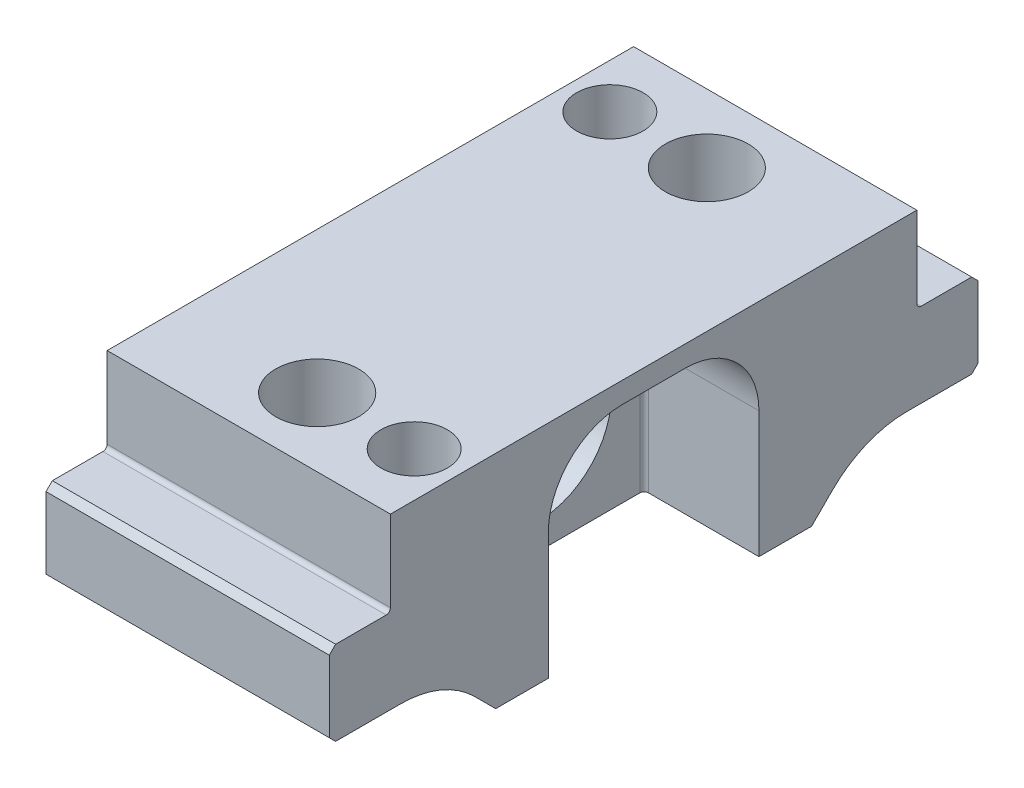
SolidWorks part; units mm, degrees
ref_plane "Front Plane" through (0, 0, 0) normal (0, 0, 1) x (1, 0, 0)
ref_plane "Top Plane" through (0, 0, 0) normal (0, 1, 0) x (1, 0, 0)
ref_plane "Right Plane" through (0, 0, 0) normal (1, 0, 0) x (0, 0, -1)
sketch "Sketch1" plane through (0, 0, 0) normal (0, 0, 1) x (1, 0, 0)
  line L0 (0, -13.335) -> (0, 13.335) construction
  line L2 (-17.0815, 13.335) -> (-17.0815, -13.335)
  line L3 (-17.0815, -13.335) -> (17.0815, -13.335)
  line L4 (17.0815, -13.335) -> (17.0815, 13.335)
  line L5 (17.0815, 13.335) -> (-17.0815, 13.335)
  dimension "D1" = 34.163
  dimension "D2" = 13.335
  dimension "D3" = 26.67
extrude "Boss-Extrude1" add sketch "Sketch1" along normal mid plane 81.28
sketch "Sketch2" plane through (17.0815, 0, 0) normal (1, 0, 0) x (0, 0, -1)
  line L0 (-39.116, 3.048) -> (-39.116, -7.0993)
  line L1 (-40.64, -13.335) -> (-19.05, -13.335)
  line L2 (-40.64, 13.335) -> (-40.64, -13.335)
  line L3 (-40.64, 13.335) -> (-31.7436, 13.335)
  line L4 (-19.05, -13.335) -> (-25.2857, -7.0993)
  line L5 (40.64, 13.335) -> (40.64, -13.335)
  line L6 (40.64, -13.335) -> (19.05, -13.335)
  line L7 (19.05, -13.335) -> (25.2857, -7.0993)
  line L8 (39.116, -7.0993) -> (25.2857, -7.0993)
  line L9 (-31.7436, 3.048) -> (-39.116, 3.048)
  line L10 (39.116, 3.048) -> (39.116, -7.0993)
  line L11 (-39.116, -7.0993) -> (-25.2857, -7.0993)
  line L12 (-31.7436, 3.048) -> (-31.7436, 13.335)
  line L13 (0, -13.335) -> (0, 13.335) construction
  line L14 (40.64, -13.335) -> (-40.64, -13.335) construction
  line L15 (31.7436, 3.048) -> (39.116, 3.048)
  line L16 (31.7436, 3.048) -> (31.7436, 13.335)
  line L17 (40.64, 13.335) -> (31.7436, 13.335)
  line L18 (-40.64, -13.335) -> (40.64, -13.335) construction
  line L19 (-40.64, 13.335) -> (40.64, 13.335) construction
  line L20 (-40.64, -13.335) -> (-40.64, 13.335) construction
  point P10 (0, 13.335)
  dimension "D1" = 63.4873
  dimension "D2" = 78.232
  dimension "D3" = 7.0993
  dimension "D4" = 10.1473
  dimension "D6" = 38.1
  dimension "D7" = 45
  dimension "D8" = 10.287
extrude "Cut-Extrude1 WAY CUTS" cut sketch "Sketch2" against normal through all
sketch "Sketch5" plane through (17.0815, 0, 0) normal (1, 0, 0) x (0, 0, -1)
  circle A0 centre (0, -1.4097) radius 8.7503
  dimension "D2" = 17.5006
  dimension "D1" = 1.4097
extrude "Cut-Extrude4 THREADED HOLE" cut sketch "Sketch5" against normal through all
sketch "Sketch6" plane through (17.0815, 0, 0) normal (1, 0, 0) x (0, 0, -1)
  line L0 (-19.05, -13.335) -> (19.05, -13.335) construction
  line L1 (-12.7, -13.335) -> (12.7, -13.335)
  line L2 (-12.7, -13.335) -> (-12.7, 10.795)
  line L3 (-12.7, 10.795) -> (12.7, 10.795)
  line L4 (12.7, -13.335) -> (12.7, 10.795)
  point P0 (0, 10.795)
  dimension "D1" = 25.4
  dimension "D2" = 24.13
extrude "Cut-Extrude5 THREAD RELIEF" cut sketch "Sketch6" against normal offset from surface (13.843 mm away) 20.32
fillet "Fillet3" radius 12.7 2 edges at (0, -7.0993, 25.2857) (0, -7.0993, -25.2857)
fillet "Fillet7" radius 8.89 2 edges at (10.16, 10.795, -12.7) (10.16, 10.795, 12.7)
fillet "Fillet5" radius 0.508 2 edges at (0, 3.048, 31.7436) (0, 3.048, -31.7436)
chamfer "Chamfer1" distance 0.762 angle 45 4 edges at (0, -7.0993, 39.116) (0, 3.048, 39.116) (0, -7.0993, -39.116) (0, 3.048, -39.116)
fillet "Fillet6" radius 0.508 5 edges at (3.2385, -5.715, -12.7) (3.2385, 8.1912, -10.0962) (3.2385, 10.795, 0) (3.2385, 8.1912, 10.0962) (3.2385, -5.715, 12.7)
hole_wizard "M10x1.5 Tapped Hole1 JAW MOUNT" positions "Sketch8" profile "Sketch7" tap size "M10x1.5" standard "ANSI Metric"
sketch "Sketch8" plane through (0, 13.335, 0) normal (0, 1, 0) x (-1, 0, 0)
  line L1 (0, 23.495) -> (0, -23.495) construction
  point P0 (0, -23.495)
  point P1 (0, 23.495)
  dimension "D1" = 46.99
sketch "Sketch7" plane through (0, 13.335, -23.495) normal (1, 0, 0) x (0, 0, 1)
  line L0 (0, 0) -> (0, 26.67)
  line L1 (0, 26.67) -> (4.25, 26.67)
  line L3 (4.25, 26.67) -> (4.25, 17.78)
  line L4 (4.25, 17.78) -> (5, 17.78)
  line L5 (5, 17.78) -> (5, 0)
  line L7 (5, 0) -> (0, 0)
  line L11 (0, -6.35) -> (0, 107.95) construction
  dimension "Thru Tap Drill Dia." = 8.5
  dimension "Thru Tap Drill Depth" = 26.67
  dimension "Thread Major Dia." = 10
  dimension "Thread Depth" = 17.78
sketch "LOCATING PIN SPREAD" plane through (0, 13.335, 0) normal (0, 1, 0) x (1, 0, 0)
  line L0 (-17.0815, 0) -> (17.0815, 0) construction
  line L1 (-17.0815, -31.7436) -> (-17.0815, 31.7436) construction
  line L2 (17.0815, -31.7436) -> (17.0815, 31.7436) construction
  line L3 (0, 23.495) -> (0, -23.495) construction
  line L4 (11.7, -23.5) -> (-11.7, 23.5) construction
  circle A0 centre (-11.7, 23.5) radius 4.0063
  circle A1 centre (11.7, -23.5) radius 4.0063
  point P12 (0, 0)
  dimension "D3" = 8.0127
  dimension "D1" = 23.4
  dimension "D2" = 47
sketch "Sketch9" plane through (0, 13.335, 0) normal (0, 1, 0) x (1, 0, 0)
  line L0 (-17.0815, 0) -> (17.0815, 0) construction
  line L2 (17.0815, -31.7436) -> (17.0815, 31.7436) construction
  line L3 (-17.0815, -31.7436) -> (-17.0815, 31.7436) construction
  circle A0 centre (-11.7, 23.5) radius 4.0094
  circle A1 centre (11.7, -23.5) radius 4.0094
  dimension "D1" = 8.0188
extrude "8MM DOWEL PIN JAW LOCATION" cut sketch "Sketch9" against normal blind 6.858
sketch "Sketch10" plane through (17.0815, 0, 0) normal (1, 0, 0) x (0, 0, -1)
  line L0 (12.7, -2.0832) -> (32.2516, -2.0832) construction
  line L1 (32.2516, 3.048) -> (38.354, 3.048) construction
  line L2 (12.7, -13.335) -> (12.7, 1.905) construction
  line L5 (32.2516, 3.048) -> (32.2516, -7.2143) construction
  arc A1 (31.7436, 3.556) -> (32.2516, 3.048) centre (32.2516, 3.556) ccw construction
  arc A2 (30.5462, -7.0993) -> (21.566, -10.819) centre (30.5462, -19.7993) ccw construction
sketch "Sketch11" plane through (17.0815, 0, 0) normal (1, 0, 0) x (0, 0, -1)
  text T0 "L" font "Century Gothic" height 6.35
extrude "Cut-Extrude1 L" [suppressed] cut sketch "Sketch11" against normal blind 0.127
sketch "Sketch12" plane through (17.0815, 0, 0) normal (1, 0, 0) x (0, 0, -1)
  text T0 "R" font "Century Gothic" height 6.35
extrude "Cut-Extrude1 R" [suppressed] cut sketch "Sketch12" against normal blind 0.127
hole_wizard "M5x0.8 Tapped Hole1" positions "Sketch14" profile "Sketch13" tap size "M5x0.8" standard "ANSI Metric"
sketch "Sketch14" plane through (0, 9.017, 0) normal (0, 1, 0) x (-1, 0, 0)
  point P0 (11.7, -23.5)
  point P1 (-11.7, 23.5)
sketch "Sketch13" plane through (-11.7, 9.017, -23.5) normal (1, 0, 0) x (0, 0, 1)
  line L0 (0, 0) -> (0, 13.6618)
  line L1 (0, 13.6618) -> (2.1, 12.4)
  line L2 (2.1, 12.4) -> (2.1, 10)
  line L3 (2.1, 10) -> (2.5, 10)
  line L4 (2.5, 10) -> (2.5, 0)
  line L5 (2.5, 0) -> (0, 0)
  line L10 (0, 13.6618) -> (-2.1, 12.4) construction
  line L11 (0, -6.35) -> (0, 107.95) construction
  dimension "Tap Drill Dia." = 4.2
  dimension "Tap Drill Depth" = 12.4
  dimension "Thread Major Dia." = 5
  dimension "Thread Depth" = 10
  dimension "Drill Angle" = 118
sketch "Sketch15" plane through (-17.0815, 0, 0) normal (-1, 0, 0) x (0, 0, 1)
  line L17 (30.5462, -7.0993) -> (38.354, -7.0993)
  line L18 (38.354, -7.0993) -> (39.116, -6.3373)
  line L19 (39.116, -6.3373) -> (39.116, 2.286)
  line L20 (39.116, 2.286) -> (38.354, 3.048)
  line L21 (38.354, 3.048) -> (32.2516, 3.048)
  line L22 (31.7436, 3.556) -> (31.7436, 13.335)
  line L23 (31.7436, 13.335) -> (-31.7436, 13.335)
  line L24 (-31.7436, 13.335) -> (-31.7436, 3.556)
  line L25 (-32.2516, 3.048) -> (-38.354, 3.048)
  line L26 (-38.354, 3.048) -> (-39.116, 2.286)
  line L27 (-39.116, 2.286) -> (-39.116, -6.3373)
  line L28 (-39.116, -6.3373) -> (-38.354, -7.0993)
  line L29 (-38.354, -7.0993) -> (-30.5462, -7.0993)
  line L30 (-21.566, -10.819) -> (-19.05, -13.335)
  line L31 (-19.05, -13.335) -> (19.05, -13.335)
  line L32 (19.05, -13.335) -> (21.566, -10.819)
  line L33 (30.5462, -7.0993) -> (38.354, -7.0993)
  line L34 (38.354, -7.0993) -> (39.116, -6.3373)
  line L35 (39.116, -6.3373) -> (39.116, 2.286)
  line L36 (39.116, 2.286) -> (38.354, 3.048)
  line L37 (38.354, 3.048) -> (32.2516, 3.048)
  line L38 (31.7436, 3.556) -> (31.7436, 13.335)
  line L39 (31.7436, 13.335) -> (-31.7436, 13.335)
  line L40 (-31.7436, 13.335) -> (-31.7436, 3.556)
  line L41 (-32.2516, 3.048) -> (-38.354, 3.048)
  line L42 (-38.354, 3.048) -> (-39.116, 2.286)
  line L43 (-39.116, 2.286) -> (-39.116, -6.3373)
  line L44 (-39.116, -6.3373) -> (-38.354, -7.0993)
  line L45 (-38.354, -7.0993) -> (-30.5462, -7.0993)
  line L46 (-21.566, -10.819) -> (-19.05, -13.335)
  line L47 (-19.05, -13.335) -> (19.05, -13.335)
  line L48 (19.05, -13.335) -> (21.566, -10.819)
  arc A4 (31.7436, 3.556) -> (32.2516, 3.048) centre (32.2516, 3.556) ccw
  arc A5 (-32.2516, 3.048) -> (-31.7436, 3.556) centre (-32.2516, 3.556) ccw
  arc A6 (-21.566, -10.819) -> (-30.5462, -7.0993) centre (-30.5462, -19.7993) ccw
  arc A7 (30.5462, -7.0993) -> (21.566, -10.819) centre (30.5462, -19.7993) ccw
  arc A8 (31.7436, 3.556) -> (32.2516, 3.048) centre (32.2516, 3.556) ccw
  arc A9 (-32.2516, 3.048) -> (-31.7436, 3.556) centre (-32.2516, 3.556) ccw
  arc A10 (-21.566, -10.819) -> (-30.5462, -7.0993) centre (-30.5462, -19.7993) ccw
  arc A11 (30.5462, -7.0993) -> (21.566, -10.819) centre (30.5462, -19.7993) ccw
  dimension "D1" = 0
extrude "Boss-Extrude2 MILL OP2" [suppressed] add sketch "Sketch15" along normal offset from surface (1.016 mm away) 31.496
sketch "Sketch16" [suppressed] plane through (0, 0, 0) normal (0, 0, 1) x (1, 0, 0)
  line L0 (-16.256, 0) -> (-21.844, 0) construction
  line L1 (-16.256, -6.477) -> (-16.256, 2.413) construction
  line L2 (-16.256, -19.05) -> (-16.256, 19.05)
  line L3 (-16.256, 19.05) -> (-19.812, 19.05)
  line L4 (-19.812, 19.05) -> (-19.812, 6.35)
  line L5 (-19.812, 6.35) -> (-21.59, 8.128)
  line L6 (-21.59, 8.128) -> (-21.844, 8.128)
  line L7 (-21.844, 8.128) -> (-21.844, -8.128)
  line L8 (15.24, 3.683) -> (15.24, 13.462) construction
  line L9 (-21.59, -8.128) -> (-21.844, -8.128)
  line L10 (-19.812, -6.35) -> (-21.59, -8.128)
  line L11 (-19.812, -19.05) -> (-19.812, -6.35)
  line L12 (-16.256, -19.05) -> (-19.812, -19.05)
  dimension "D1" = 45
  dimension "D2" = 0.254
  dimension "D3" = 6.35
  dimension "D4" = 2.032
  dimension "D5" = 19.05
  dimension "D6" = 35.052
extrude "Boss-Extrude3 MILL OP2 DOVETAIL" [suppressed] add sketch "Sketch16" along normal mid plane 81.28
sketch "Sketch17" [suppressed] plane through (-16.256, 0, 0) normal (1, 0, 0) x (0, 0, -1)
  line L0 (-31.877, 19.05) -> (-40.64, 19.05)
  line L1 (-40.64, 19.05) -> (-40.64, 3.175)
  line L2 (-40.64, 3.175) -> (-32.385, 3.175)
  line L3 (-31.877, 3.683) -> (-31.877, 19.05)
  line L4 (40.64, 19.05) -> (40.64, 3.175)
  line L5 (31.877, 19.05) -> (40.64, 19.05)
  line L6 (-40.64, -19.05) -> (-40.64, 19.05) construction
  line L7 (31.877, 3.683) -> (31.877, 19.05)
  line L8 (0, -19.05) -> (0, 19.05) construction
  line L9 (40.64, 3.175) -> (32.385, 3.175)
  line L10 (-40.64, -19.05) -> (40.64, -19.05) construction
  line L11 (-40.64, 19.05) -> (40.64, 19.05) construction
  arc A0 (-32.385, 3.175) -> (-31.877, 3.683) centre (-32.385, 3.683) ccw construction
  arc A1 (-32.385, 3.175) -> (-31.877, 3.683) centre (-32.385, 3.683) ccw
  arc A2 (32.385, 3.175) -> (31.877, 3.683) centre (32.385, 3.683) cw
extrude "Cut-Extrude1 MILL OP2 WAY CUTS" [suppressed] cut sketch "Sketch17" against normal through all
sketch "Sketch18" plane through (-17.0815, 0, 0) normal (-1, 0, 0) x (0, 0, 1)
  line L16 (30.5462, -7.0993) -> (38.354, -7.0993)
  line L17 (38.354, -7.0993) -> (39.116, -6.3373)
  line L18 (39.116, -6.3373) -> (39.116, 2.286)
  line L19 (39.116, 2.286) -> (38.354, 3.048)
  line L20 (38.354, 3.048) -> (32.2516, 3.048)
  line L21 (31.7436, 3.556) -> (31.7436, 13.335)
  line L22 (31.7436, 13.335) -> (-31.7436, 13.335)
  line L23 (-31.7436, 13.335) -> (-31.7436, 3.556)
  line L24 (-32.2516, 3.048) -> (-38.354, 3.048)
  line L25 (-38.354, 3.048) -> (-39.116, 2.286)
  line L26 (-39.116, 2.286) -> (-39.116, -6.3373)
  line L27 (-39.116, -6.3373) -> (-38.354, -7.0993)
  line L28 (-38.354, -7.0993) -> (-30.5462, -7.0993)
  line L29 (-21.566, -10.819) -> (-19.05, -13.335)
  line L30 (-19.05, -13.335) -> (19.05, -13.335)
  line L31 (19.05, -13.335) -> (21.566, -10.819)
  line L32 (30.5462, -7.0993) -> (38.354, -7.0993)
  line L33 (38.354, -7.0993) -> (39.116, -6.3373)
  line L34 (39.116, -6.3373) -> (39.116, 2.286)
  line L35 (39.116, 2.286) -> (38.354, 3.048)
  line L36 (38.354, 3.048) -> (32.2516, 3.048)
  line L37 (31.7436, 3.556) -> (31.7436, 13.335)
  line L38 (31.7436, 13.335) -> (-31.7436, 13.335)
  line L39 (-31.7436, 13.335) -> (-31.7436, 3.556)
  line L40 (-32.2516, 3.048) -> (-38.354, 3.048)
  line L41 (-38.354, 3.048) -> (-39.116, 2.286)
  line L42 (-39.116, 2.286) -> (-39.116, -6.3373)
  line L43 (-39.116, -6.3373) -> (-38.354, -7.0993)
  line L44 (-38.354, -7.0993) -> (-30.5462, -7.0993)
  line L45 (-21.566, -10.819) -> (-19.05, -13.335)
  line L46 (-19.05, -13.335) -> (19.05, -13.335)
  line L47 (19.05, -13.335) -> (21.566, -10.819)
  circle A0 centre (0, -1.4097) radius 8.7503 construction
  circle A1 centre (0, -1.4097) radius 8.7503
  arc A4 (31.7436, 3.556) -> (32.2516, 3.048) centre (32.2516, 3.556) ccw
  arc A5 (-32.2516, 3.048) -> (-31.7436, 3.556) centre (-32.2516, 3.556) ccw
  arc A6 (-21.566, -10.819) -> (-30.5462, -7.0993) centre (-30.5462, -19.7993) ccw
  arc A7 (30.5462, -7.0993) -> (21.566, -10.819) centre (30.5462, -19.7993) ccw
  arc A8 (31.7436, 3.556) -> (32.2516, 3.048) centre (32.2516, 3.556) ccw
  arc A9 (-32.2516, 3.048) -> (-31.7436, 3.556) centre (-32.2516, 3.556) ccw
  arc A10 (-21.566, -10.819) -> (-30.5462, -7.0993) centre (-30.5462, -19.7993) ccw
  arc A11 (30.5462, -7.0993) -> (21.566, -10.819) centre (30.5462, -19.7993) ccw
  dimension "D1" = 0
extrude ".005 EXTRA MAT " [suppressed] add sketch "Sketch18" along normal blind 0.127
sketch "Sketch21" plane through (-17.0815, 0, 0) normal (-1, 0, 0) x (0, 0, 1)
  text T0 "R" font "Century Gothic" height 6.35
extrude "Cut-ExtrudeR" cut sketch "Sketch21" against normal blind 0.127
sketch "Sketch22" plane through (-17.0815, 0, 0) normal (-1, 0, 0) x (0, 0, 1)
  text T0 "L" font "Century Gothic" height 6.35
extrude "Cut-Extrude L" [suppressed] cut sketch "Sketch22" against normal blind 0.127
ref_plane "Plane1" through (0, -2.0256, 0) normal (0, 1, 0) x (1, 0, 0)
ref_plane "Plane2" through (0, 0, 0) normal (0, 0, -1) x (-1, 0, 0)
ref_plane "Plane3" through (0, 0, 0) normal (-1, 0, 0) x (0, 0, 1)
